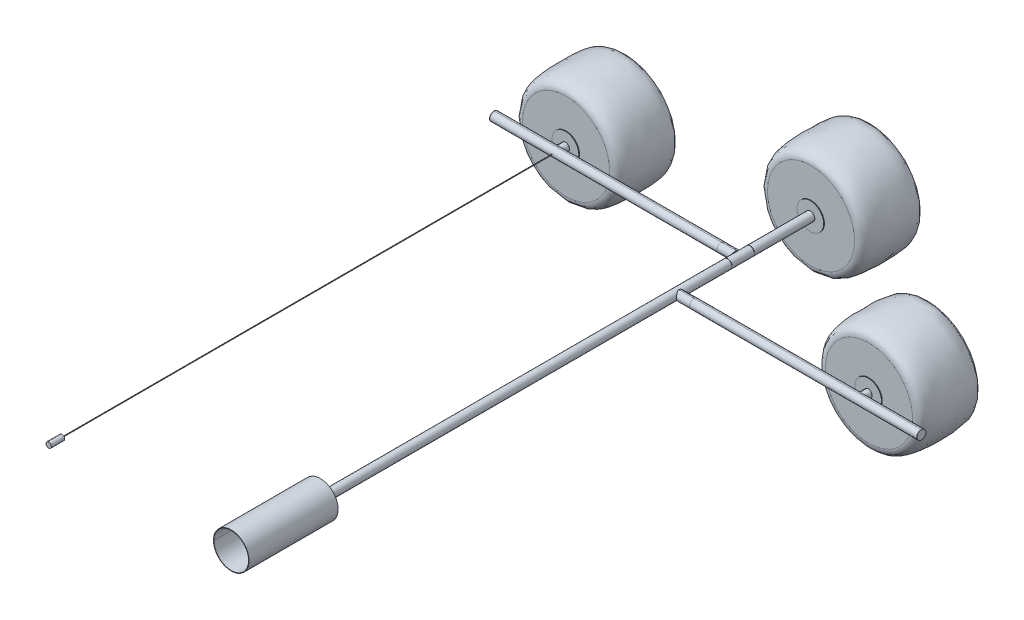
SolidWorks part; units mm, degrees
ref_plane "Alzado" through (0, 0, 0) normal (0, 0, 1) x (1, 0, 0)
ref_plane "Planta" through (0, 0, 0) normal (0, 1, 0) x (1, 0, 0)
ref_plane "Vista lateral" through (0, 0, 0) normal (1, 0, 0) x (0, 0, -1)
imported_body "Manises Colgante triple.igs<1>"
delete or keep bodies "Sólido-Eliminar/Conservar 1" type delete bodies bodies 492
delete or keep bodies "Sólido-Eliminar/Conservar 2" type delete bodies bodies 491
